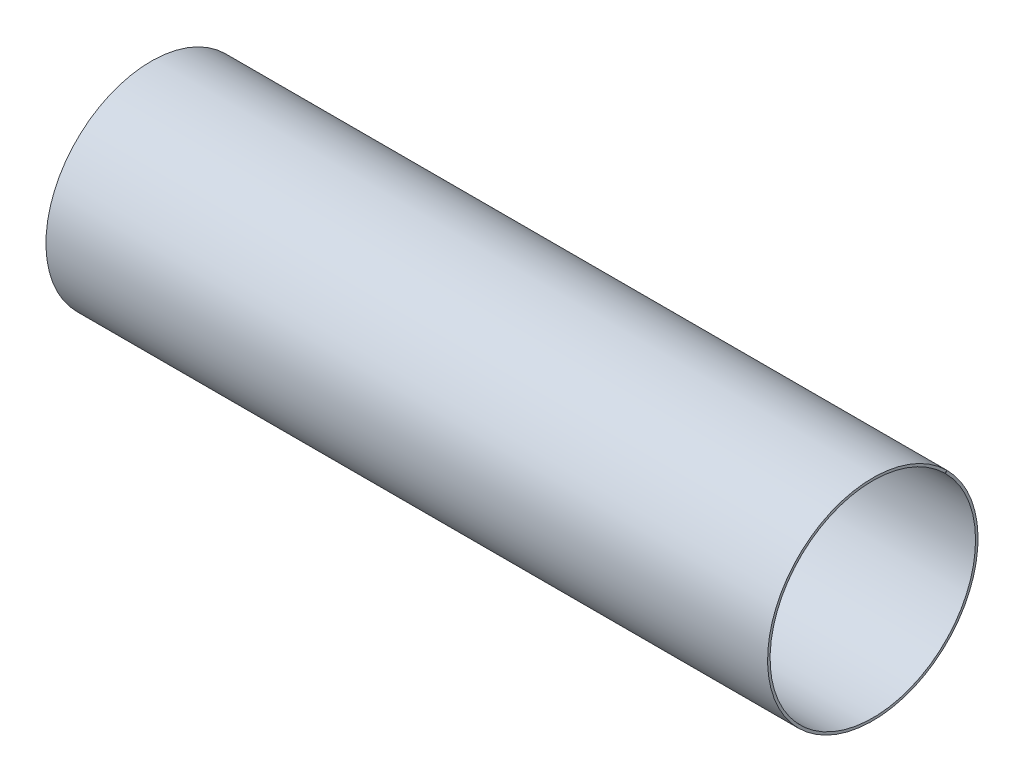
SolidWorks part; units mm, degrees
ref_plane "Front Plane" through (0, 0, 0) normal (0, 0, 1) x (1, 0, 0)
ref_plane "Top Plane" through (0, 0, 0) normal (0, 1, 0) x (1, 0, 0)
ref_plane "Right Plane" through (0, 0, 0) normal (1, 0, 0) x (0, 0, -1)
sketch "Sketch1" plane through (0, 0, 0) normal (1, 0, 0) x (0, 0, -1)
  line L2 (374.919, 379.4091) -> (365.9924, 370.3756) construction
  line L3 (368.1905, 368.1905) -> (377.1708, 377.1708) construction
  line L4 (374.919, 379.4091) -> (365.9924, 370.3756)
  line L5 (368.1905, 368.1905) -> (377.1708, 377.1708)
  arc A2 (365.9924, 370.3756) -> (368.1905, 368.1905) centre (0, 0) ccw construction
  arc A3 (374.919, 379.4091) -> (377.1708, 377.1708) centre (0, 0) ccw construction
  arc A4 (365.9924, 370.3756) -> (368.1905, 368.1905) centre (0, 0) ccw
  arc A5 (374.919, 379.4091) -> (377.1708, 377.1708) centre (0, 0) ccw
extrude "Extrude1" add sketch "Sketch1" along normal up to vertex and the other way up to vertex
sheet metal parameters "Sheet-Metal1" parameters "D1"=6.35
bend "RoundBend1" bend radius 520.7 bend angle 359.659 parameters "D5"=1
flatten bends "Flatten-Bends1" parameters "D1"=0
sketch "Sharp-Sketch1" plane through (0, 379.4091, -374.919) normal (0, 0.7113, -0.7029) x (-1, 0, 0)
  line L0 (-1828.8, 1651.856) -> (1828.8, 1651.856) construction
process bends "Process-Bends1" parameters "D1"=0
sketch "Flat-Sketch1" plane through (0, 379.4091, -374.919) normal (0, 0.7113, -0.7029) x (-1, 0, 0)
